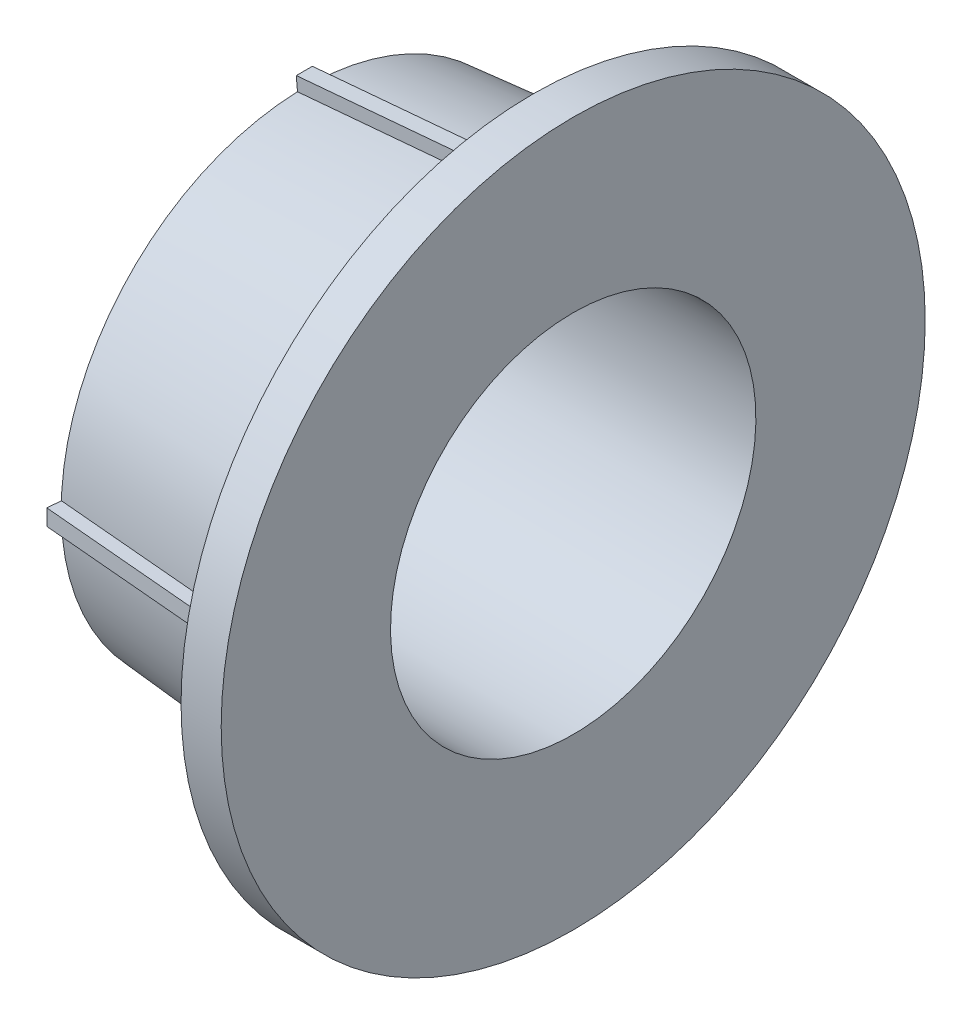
SolidWorks part; units mm, degrees
ref_plane "Plan de face" through (0, 0, 0) normal (0, 0, 1) x (1, 0, 0)
ref_plane "Plan de dessus" through (0, 0, 0) normal (0, 1, 0) x (1, 0, 0)
ref_plane "Plan de droite" through (0, 0, 0) normal (1, 0, 0) x (0, 0, -1)
imported_body "Importée1"
other "Répétition circulaire5"
